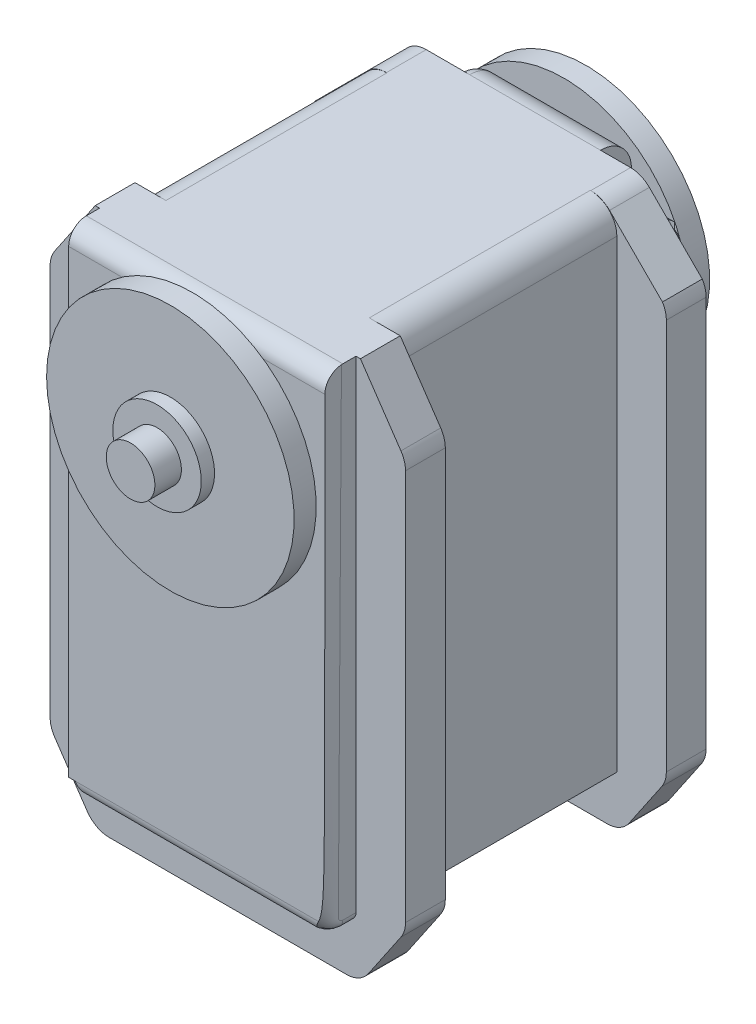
SolidWorks part; units mm, degrees
ref_plane "Front Plane" through (0, 0, 0) normal (0, 0, 1) x (1, 0, 0)
ref_plane "Top Plane" through (0, 0, 0) normal (0, 1, 0) x (1, 0, 0)
ref_plane "Right Plane" through (0, 0, 0) normal (1, 0, 0) x (0, 0, -1)
imported_body "Imported3"
ref_plane "Plane5" through (16.302, 11.0853, 0) normal (0.8269, 0.5623, 0) x (-0.5623, 0.8269, 0)
ref_plane "Plane6" through (14.5, 0, 0) normal (-1, 0, 0) x (0, -1, 0)
hole_wizard "Ø15.0 (15) Diameter Hole1" positions "Sketch36" profile "Sketch35" hole size "Ø15.0" standard "ANSI Metric"
sketch "Sketch36" plane through (0, 0, -20.5) normal (0, 0, -1) x (-1, 0, 0)
  point P0 (0, 0)
sketch "Sketch35" plane through (0, 0, -20.5) normal (1, 0, 0) x (0, 1, 0)
  line L0 (0, 0) -> (0, 1)
  line L1 (0, 1) -> (7.5, 1)
  line L2 (7.5, 1) -> (7.5, 0)
  line L5 (7.5, 0) -> (0, 0)
  line L10 (0, 1) -> (-7.5, 1) construction
  line L11 (0, -6.35) -> (0, 107.95) construction
  dimension "Hole Dia." = 15
  dimension "Hole Depth" = 1
  dimension "Drill Angle" = 180
ref_plane "Plane7" through (0, 0, 0) normal (0, -1, 0) x (1, 0, 0)
sketch "Sketch37" plane through (0, 0, 0) normal (0, -1, 0) x (1, 0, 0)
  line L0 (2.75, 28) -> (0, 28)
  line L1 (0, 28) -> (0, 20.5)
  line L2 (0, 20.5) -> (5.5, 20.5)
  line L3 (5.5, 20.5) -> (5.5, 21)
  line L4 (5.5, 21) -> (14, 21)
  line L5 (14, 21) -> (14, 23.5)
  line L6 (14, 23.5) -> (5, 23.5)
  line L7 (5, 23.5) -> (5, 25)
  line L8 (5, 25) -> (2.75, 25)
  line L9 (2.75, 25) -> (2.75, 28)
  line L10 (0, 28) -> (0, 20.5) construction
revolve "Revolve1" add sketch "Sketch37" angle 360 about L10
sketch "Sketch38" plane through (0, 0, 0) normal (0, -1, 0) x (1, 0, 0)
  line L0 (5, -19.5) -> (0, -19.5)
  line L1 (0, -19.5) -> (0, -26.1)
  line L2 (0, -26.1) -> (2.75, -26.1)
  line L3 (2.75, -26.1) -> (2.75, -24.3)
  line L4 (2.75, -24.3) -> (4.75, -24.3)
  line L5 (4.75, -24.3) -> (4.75, -23.5)
  line L6 (4.75, -23.5) -> (14, -23.5)
  line L7 (14, -23.5) -> (14, -21)
  line L8 (14, -21) -> (7.25, -21)
  line L9 (7.25, -21) -> (7.25, -19.8)
  line L10 (7.25, -19.8) -> (5, -19.8)
  line L11 (5, -19.8) -> (5, -19.5)
  line L12 (0, -19.5) -> (0, -26.1) construction
revolve "Revolve2" add sketch "Sketch38" angle 360 about L12
fillet "Fillet2" radius 2 1 edges at (-0.0112, 13, 20.5)
fillet "Fillet3" radius 2.35 1 edges at (8.15, 6.65, -18.75)
fillet "Fillet5" radius 3 12 edges at (-20.1, 5.5, -14.75) (20.1, -40.6, -15.75) (-15, -48.1, -15.75) (-20.1, 5.5, 14.75) (20.1, 5.5, 14.75) (-20.1, -40.6, 15.75) (-20.1, -40.6, -15.75) (-15, -48.1, 15.75) (15, -48.1, -15.75) (15, -48.1, 15.75) (20.1, -40.6, 15.75) (20.1, 5.5, -14.75)
sketch "Sketch51" plane through (14.5, 0, 0) normal (1, 0, 0) x (0, 0, -1)
  line L0 (-12.5, -18.1003) -> (-12.5, -17.8997)
  line L1 (12.5, -18.1003) -> (12.5, -17.8997)
  line L2 (12.5, 3.8997) -> (12.5, 4.1003)
  line L3 (-12.5, 3.8997) -> (-12.5, 4.1003)
  line L4 (12.5, 4.1003) -> (12.5, 13)
  line L5 (12.5, 13) -> (-12.5, 13)
  line L6 (-12.5, 13) -> (-12.5, 4.1003)
  line L7 (-12.5, 4.1003) -> (12.5, 4.1003)
  line L8 (12.5, 4.1003) -> (12.5, 13)
  line L9 (12.5, 13) -> (-12.5, 13)
  line L10 (-12.5, 13) -> (-12.5, 4.1003)
  line L12 (12.5, -42.5) -> (12.5, -47.8958)
  line L13 (12.5, -47.8958) -> (14.5, -47.8958)
  line L14 (14.5, -47.8958) -> (14.5, -39.25)
  line L15 (14.5, -39.25) -> (12.5, -39.25)
  line L16 (12.5, -39.25) -> (12.5, -18.1003)
  line L17 (12.5, -18.1003) -> (-12.5, -18.1003)
  line L18 (-12.5, -18.1003) -> (-12.5, -21.975)
  line L19 (-12.5, -21.975) -> (-14.5, -21.975)
  line L20 (-14.5, -21.975) -> (-14.5, -47.8958)
  line L21 (-14.5, -47.8958) -> (-12.5, -47.8958)
  line L22 (-12.5, -47.8958) -> (-12.5, -42.5)
  line L23 (-12.5, -42.5) -> (12.5, -42.5)
  line L24 (12.5, -42.5) -> (12.5, -47.8958)
  line L25 (12.5, -47.8958) -> (14.5, -47.8958)
  line L26 (14.5, -47.8958) -> (14.5, -39.25)
  line L27 (14.5, -39.25) -> (12.5, -39.25)
  line L28 (12.5, -39.25) -> (12.5, -18.1003)
  line L30 (-12.5, -18.1003) -> (-12.5, -21.975)
  line L31 (-12.5, -21.975) -> (-14.5, -21.975)
  line L32 (-14.5, -21.975) -> (-14.5, -47.8958)
  line L33 (-14.5, -47.8958) -> (-12.5, -47.8958)
  line L34 (-12.5, -47.8958) -> (-12.5, -42.5)
  line L35 (-12.5, -42.5) -> (12.5, -42.5)
  line L36 (-12.5, -17.8997) -> (12.5, -17.8997)
  line L37 (12.5, -17.8997) -> (12.5, 3.8997)
  line L38 (12.5, 3.8997) -> (-12.5, 3.8997)
  line L39 (-12.5, 3.8997) -> (-12.5, -17.8997)
  line L41 (12.5, -17.8997) -> (12.5, 3.8997)
  line L43 (-12.5, 3.8997) -> (-12.5, -17.8997)
  dimension "D1" = 0
  dimension "D2" = 0
  dimension "D3" = 0
extrude "Boss-Extrude6" add sketch "Sketch51" against normal blind 0.1
mirror "Mirror1" about plane through (0, 0, 0) normal (1, 0, 0) of "Boss-Extrude6"
fillet "Fillet8" radius 3 2 edges at (-14.5, 13, 0) (14.5, 13, 0)
chamfer "Chamfer2" distance 2.2 angle 45 2 edges at (-15, 13, -14.75) (15, 13, -14.75)
fillet "Fillet9" radius 3 2 edges at (12.8, 13, -14.75) (-12.8, 13, -14.75)
sketch "Sketch52" plane through (0, 0, 14.5) normal (0, 0, -1) x (-1, 0, 0)
  line L4 (15.8929, -46.7869) -> (19.5808, -41.3636)
  line L5 (20.1, -39.6766) -> (20.1, -21.975)
  line L6 (20.1, -21.975) -> (14.5, -21.975)
  line L7 (14.5, -21.975) -> (14.5, -47.8958)
  line L8 (15.8929, -46.7869) -> (19.5808, -41.3636)
  line L9 (20.1, -39.6766) -> (20.1, -21.975)
  line L10 (20.1, -21.975) -> (14.5, -21.975)
  line L11 (14.5, -21.975) -> (14.5, -47.8958)
  arc A2 (19.5808, -41.3636) -> (20.1, -39.6766) centre (17.1, -39.6766) ccw
  arc A3 (14.5, -47.8958) -> (15.8929, -46.7869) centre (13.4121, -45.1) ccw
  arc A4 (19.5808, -41.3636) -> (20.1, -39.6766) centre (17.1, -39.6766) ccw
  arc A5 (14.5, -47.8958) -> (15.8929, -46.7869) centre (13.4121, -45.1) ccw
  dimension "D1" = 0
extrude "Boss-Extrude7" add sketch "Sketch52" along normal up to surface (2 mm away)
sketch "Sketch53" plane through (0, 0, 14.5) normal (0, 0, -1) x (-1, 0, 0)
  line L4 (-19.5808, -41.3636) -> (-15.8929, -46.7869)
  line L5 (-14.5, -47.8958) -> (-14.5, -21.975)
  line L6 (-14.5, -21.975) -> (-20.1, -21.975)
  line L7 (-20.1, -21.975) -> (-20.1, -39.6766)
  line L8 (-19.5808, -41.3636) -> (-15.8929, -46.7869)
  line L9 (-14.5, -47.8958) -> (-14.5, -21.975)
  line L10 (-14.5, -21.975) -> (-20.1, -21.975)
  line L11 (-20.1, -21.975) -> (-20.1, -39.6766)
  arc A2 (-15.8929, -46.7869) -> (-14.5, -47.8958) centre (-13.4121, -45.1) ccw
  arc A3 (-20.1, -39.6766) -> (-19.5808, -41.3636) centre (-17.1, -39.6766) ccw
  arc A4 (-15.8929, -46.7869) -> (-14.5, -47.8958) centre (-13.4121, -45.1) ccw
  arc A5 (-20.1, -39.6766) -> (-19.5808, -41.3636) centre (-17.1, -39.6766) ccw
  dimension "D1" = 0
extrude "Boss-Extrude8" add sketch "Sketch53" along normal up to surface (2 mm away)
sketch "Sketch54" plane through (0, 0, -14.5) normal (0, 0, 1) x (1, 0, 0)
  line L4 (15.8929, -46.7869) -> (19.5808, -41.3636)
  line L5 (20.1, -39.6766) -> (20.1, -39.25)
  line L6 (20.1, -39.25) -> (14.5, -39.25)
  line L7 (14.5, -39.25) -> (14.5, -47.8958)
  line L8 (15.8929, -46.7869) -> (19.5808, -41.3636)
  line L9 (20.1, -39.6766) -> (20.1, -39.25)
  line L10 (20.1, -39.25) -> (14.5, -39.25)
  line L11 (14.5, -39.25) -> (14.5, -47.8958)
  arc A2 (19.5808, -41.3636) -> (20.1, -39.6766) centre (17.1, -39.6766) ccw
  arc A3 (14.5, -47.8958) -> (15.8929, -46.7869) centre (13.4121, -45.1) ccw
  arc A4 (19.5808, -41.3636) -> (20.1, -39.6766) centre (17.1, -39.6766) ccw
  arc A5 (14.5, -47.8958) -> (15.8929, -46.7869) centre (13.4121, -45.1) ccw
  dimension "D1" = 0
extrude "Boss-Extrude9" add sketch "Sketch54" along normal up to surface (2 mm away)
sketch "Sketch55" plane through (0, 0, -14.5) normal (0, 0, 1) x (1, 0, 0)
  line L4 (-19.5808, -41.3636) -> (-15.8929, -46.7869)
  line L5 (-14.5, -47.8958) -> (-14.5, -39.25)
  line L6 (-14.5, -39.25) -> (-20.1, -39.25)
  line L7 (-20.1, -39.25) -> (-20.1, -39.6766)
  line L8 (-19.5808, -41.3636) -> (-15.8929, -46.7869)
  line L9 (-14.5, -47.8958) -> (-14.5, -39.25)
  line L10 (-14.5, -39.25) -> (-20.1, -39.25)
  line L11 (-20.1, -39.25) -> (-20.1, -39.6766)
  arc A2 (-15.8929, -46.7869) -> (-14.5, -47.8958) centre (-13.4121, -45.1) ccw
  arc A3 (-20.1, -39.6766) -> (-19.5808, -41.3636) centre (-17.1, -39.6766) ccw
  arc A4 (-15.8929, -46.7869) -> (-14.5, -47.8958) centre (-13.4121, -45.1) ccw
  arc A5 (-20.1, -39.6766) -> (-19.5808, -41.3636) centre (-17.1, -39.6766) ccw
  dimension "D1" = 0
extrude "Boss-Extrude10" add sketch "Sketch55" along normal up to surface (2 mm away)
sketch "Sketch56" plane through (0, -42.5, 0) normal (0, -1, 0) x (1, 0, 0)
  line L0 (-11.1003, 12.5) -> (-10.8997, 12.5)
  line L1 (-11.1003, -12.5) -> (-10.8997, -12.5)
  line L2 (10.8997, -12.5) -> (11.1003, -12.5)
  line L3 (10.8997, 12.5) -> (11.1003, 12.5)
  line L4 (-11.1003, 12.5) -> (-14.5, 12.5)
  line L5 (-14.5, 12.5) -> (-14.5, -12.5)
  line L6 (-14.5, -12.5) -> (-11.1003, -12.5)
  line L7 (-11.1003, -12.5) -> (-11.1003, 12.5)
  line L8 (-11.1003, 12.5) -> (-14.5, 12.5)
  line L9 (-14.5, 12.5) -> (-14.5, -12.5)
  line L10 (-14.5, -12.5) -> (-11.1003, -12.5)
  line L12 (10.8997, -12.5) -> (10.8997, 12.5)
  line L13 (10.8997, 12.5) -> (-10.8997, 12.5)
  line L14 (-10.8997, 12.5) -> (-10.8997, -12.5)
  line L15 (-10.8997, -12.5) -> (10.8997, -12.5)
  line L17 (10.8997, 12.5) -> (-10.8997, 12.5)
  line L19 (-10.8997, -12.5) -> (10.8997, -12.5)
  line L20 (11.1003, 12.5) -> (11.1003, -12.5)
  line L21 (11.1003, -12.5) -> (14.5, -12.5)
  line L22 (14.5, -12.5) -> (14.5, 12.5)
  line L23 (14.5, 12.5) -> (11.1003, 12.5)
  line L25 (11.1003, -12.5) -> (14.5, -12.5)
  line L26 (14.5, -12.5) -> (14.5, 12.5)
  line L27 (14.5, 12.5) -> (11.1003, 12.5)
  dimension "D1" = 0
  dimension "D2" = 0
  dimension "D3" = 0
extrude "Boss-Extrude11" add sketch "Sketch56" against normal blind 0.1
